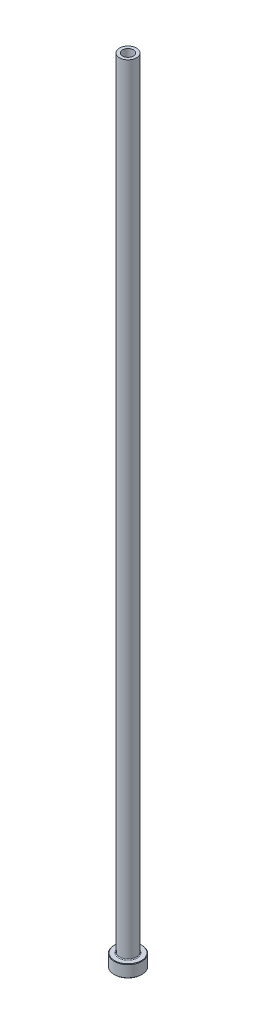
SolidWorks part; units mm, degrees
ref_plane "Front Plane" through (0, 0, 0) normal (0, 0, 1) x (1, 0, 0)
ref_plane "Top Plane" through (0, 0, 0) normal (0, 1, 0) x (1, 0, 0)
ref_plane "Right Plane" through (0, 0, 0) normal (1, 0, 0) x (0, 0, -1)
sketch "Sketch1" plane through (0, 0, 0) normal (0, 0, 1) x (1, 0, 0)
  line L0 (0, 0) -> (0, 50000) construction
  line L1 (0, 0) -> (7.1374, 0)
  line L2 (7.1374, 0) -> (7.1374, 6.35)
  line L3 (7.1374, 6.35) -> (4.7555, 6.35)
  line L4 (4.3586, 6.7469) -> (4.3586, 406.4)
  line L5 (4.3586, 406.4) -> (0, 406.4)
  line L6 (0, 406.4) -> (0, 0)
  arc A0 (4.3586, 6.7469) -> (4.7555, 6.35) centre (4.7555, 6.7469) ccw
  dimension "D5" = 0.3969
  dimension "D1" = 8.7173
  dimension "D2" = 14.2748
  dimension "D3" = 6.35
  dimension "D4" = 406.4
revolve "Revolve1" add sketch "Sketch1" angle 360 about L0
sketch "Sketch2" plane through (0, 0, 0) normal (0, 0, 1) x (1, 0, 0)
  line L0 (0, 0) -> (0, 50000) construction
  line L1 (-7.1374, 0) -> (7.1374, 0) construction
  line L2 (3.3655, 0) -> (2.9686, 0.3969)
  line L3 (2.9686, 0.3969) -> (2.9686, 322.2625)
  line L4 (2.9686, 322.2625) -> (2.7775, 336.55)
  line L5 (2.7775, 336.55) -> (2.7775, 406.4)
  line L6 (4.3586, 406.4) -> (-4.3586, 406.4) construction
  line L7 (2.7775, 406.4) -> (0, 406.4)
  line L8 (0, 406.4) -> (0, 0)
  line L9 (0, 0) -> (3.3655, 0)
  point P4 (0, 0)
  dimension "D1" = 0.3969
  dimension "D2" = 45
  dimension "D3" = 5.555
  dimension "D4" = 5.9372
  dimension "D5" = 69.85
  dimension "D6" = 14.2875
revolve "Cut-Revolve1" cut sketch "Sketch2" angle 360 about L0
chamfer "Chamfer1" distance 0.254 angle 45 2 edges at (0, 0, -7.1374) (0, 6.35, -7.1374)
